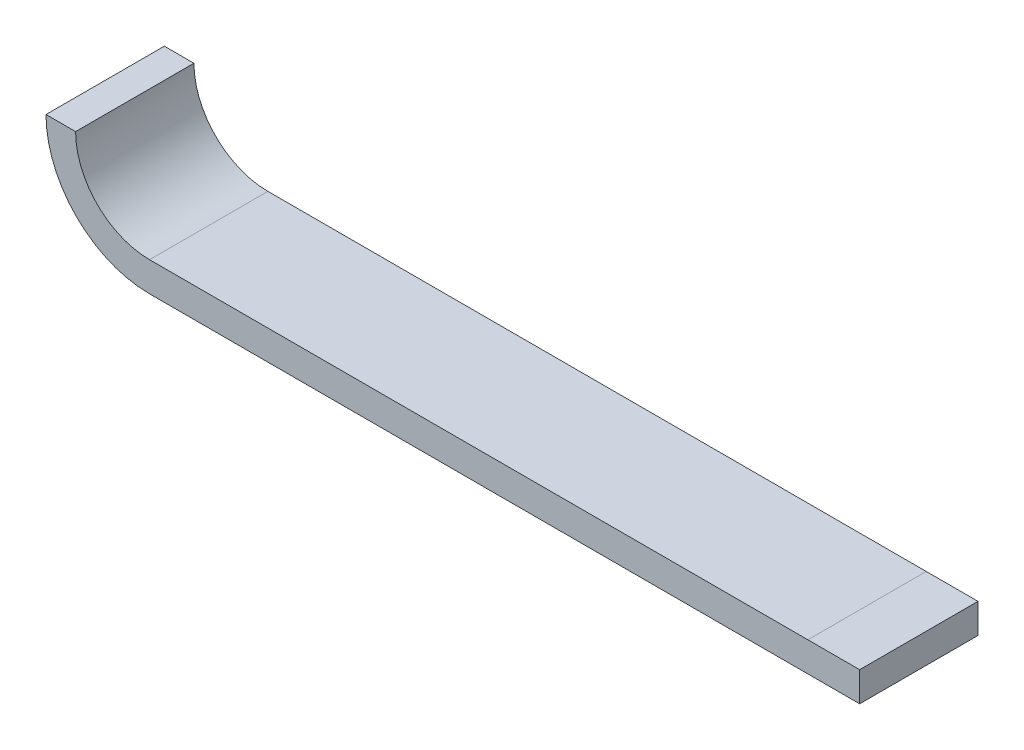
SolidWorks part; units mm, degrees
ref_plane "Front" through (0, 0, 0) normal (0, 0, 1) x (1, 0, 0)
ref_plane "Top" through (0, 0, 0) normal (0, 1, 0) x (1, 0, 0)
ref_plane "Right" through (0, 0, 0) normal (1, 0, 0) x (0, 0, -1)
sketch "Sketch1" plane through (0, 0, 0) normal (0, 0, 1) x (1, 0, 0)
  line L0 (0, 0) -> (304.8, 0) construction
  line L1 (0, -71.3124) -> (0, 105.0097) construction
  line L3 (304.8, -98.6668) -> (304.8, 123.4043) construction
  line L4 (0, -38.1) -> (304.8, -38.1)
  line L5 (0, 0) -> (-82.7493, 0) construction
  arc A3 (-38.1, 0) -> (0, -38.1) centre (0, 0) ccw
  dimension "D2" = 76.2
  dimension "D3" = 304.8
ref_plane "Plane1" through (304.8, 0, 0) normal (1, 0, 0) x (0, 0, -1)
sketch "Sketch2" plane through (304.8, 0, 0) normal (1, 0, 0) x (0, 0, -1)
  line L0 (-106.2603, -38.1) -> (108.8076, -38.1) construction
  line L1 (0, -98.6668) -> (0, 114.9253) construction
  line L2 (0, -98.6668) -> (0, 123.4043) construction
  line L4 (-25.4, -31.75) -> (25.4, -31.75)
  line L5 (-25.4, -31.75) -> (-25.4, -44.45)
  line L6 (-25.4, -44.45) -> (25.4, -44.45)
  line L7 (25.4, -31.75) -> (25.4, -44.45)
  dimension "D1" = 50.8
  dimension "D2" = 25.4
  dimension "D3" = 12.7
  dimension "D4" = 6.35
sweep "Base-Sweep" add profiles "Sketch2" path "Sketch1"
sketch "Sketch6" plane through (0, -31.75, 0) normal (0, 1, 0) x (-1, 0, 0)
  line L0 (-282.575, 25.4) -> (-282.575, -25.4)
  line L1 (0, -25.4) -> (-304.8, -25.4) construction
  line L2 (0, 25.4) -> (-304.8, 25.4) construction
  line L3 (-282.575, -25.4) -> (-304.8, -25.4)
  line L4 (0, 25.4) -> (-304.8, 25.4) construction
  line L5 (0, -25.4) -> (-304.8, -25.4) construction
  line L6 (-304.8, -25.4) -> (-304.8, 25.4) construction
  line L7 (-282.575, 25.4) -> (-304.8, 25.4)
  line L8 (-304.8, -25.4) -> (-304.8, 25.4)
  dimension "D1" = 22.225
sketch "Sketch8" plane through (0, -44.45, 0) normal (0, -1, 0) x (1, 0, 0)
  line L0 (152.4, 25.4) -> (152.4, -25.4)
  line L1 (0, -25.4) -> (304.8, -25.4) construction
  line L2 (0, 25.4) -> (304.8, 25.4) construction
